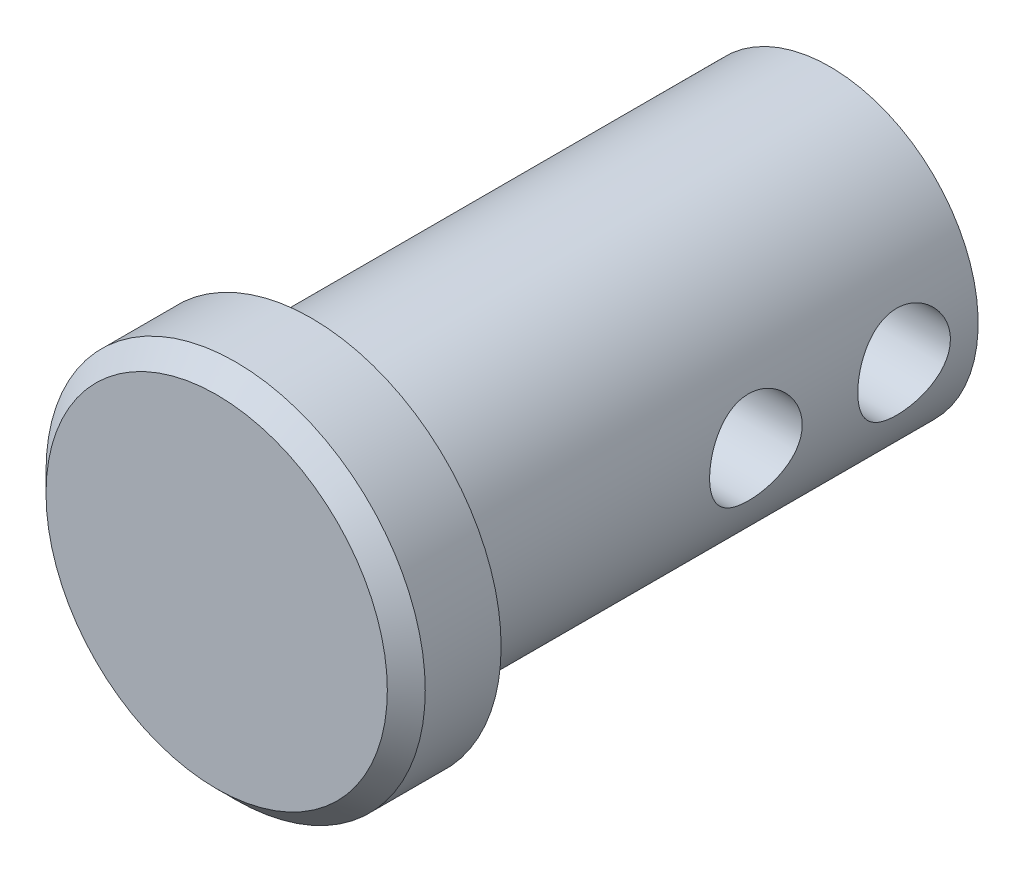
SolidWorks part; units mm, degrees
ref_plane "Front" through (0, 0, 0) normal (0, 0, 1) x (1, 0, 0)
ref_plane "Top" through (0, 0, 0) normal (0, 1, 0) x (1, 0, 0)
ref_plane "Right" through (0, 0, 0) normal (1, 0, 0) x (0, 0, -1)
sketch "Sketch1" plane through (0, 0, 0) normal (0, 0, 1) x (1, 0, 0)
  circle A0 centre (0, 0) radius 6.35
  point P3 (0, 6.35)
  point P4 (0, -6.35)
  dimension "dia" = 12.7
extrude "Extrude1" add sketch "Sketch1" along normal mid plane 50.8
sketch "Sketch2" plane through (0, 0, 25.4) normal (0, 0, 1) x (1, 0, 0)
  circle A0 centre (0, 0) radius 8.128
  dimension "head dia" = 16.256
extrude "Extrude2" add sketch "Sketch2" along normal blind 4.064
chamfer "Chamfer1" distance 0.8128 angle 45 1 edges at (8.128, 0, 29.464)
sketch "Sketch3" plane through (0, 0, 0) normal (1, 0, 0) x (0, 0, -1)
  line L1 (25.4, -6.35) -> (25.4, 6.35) construction
  circle A0 centre (19.05, 0) radius 1.9844
  point P2 (17.0656, 0)
  dimension "D1" = 6.35
  dimension "hole dia" = 3.9688
extrude "Extrude3" cut sketch "Sketch3" against normal through all and the other way through all
pattern_linear "LPattern1" count 6 spacing 6.35 along (0, 0, 1) of "Extrude3"
chamfer "Chamfer2" distance 0.635 angle 45 1 edges at (6.35, 0, -25.4)
ref_plane "Plane1" through (0, 0, -19.05) normal (0, 0, 1) x (1, 0, 0)
sketch "Sketch9" plane through (0, 0, 0) normal (1, 0, 0) x (0, 0, -1)
  line L0 (0, 0) -> (-6.35, 0) construction
  line L1 (-3.175, 6.35) -> (-3.175, -6.35)
  line L2 (24.765, 6.35) -> (-25.4, 6.35) construction
  line L3 (-25.4, -6.35) -> (24.765, -6.35) construction
  point P9 (-3.175, 0)
extrude "Cut-Extrude1" cut sketch "Sketch9" against normal through all and the other way through all
equation "\"D1@Chamfer1\" = \"head ht@Extrude2\" * .2"
equation "\"D1@Chamfer2\" = \"dia@Sketch1\" * .05"
